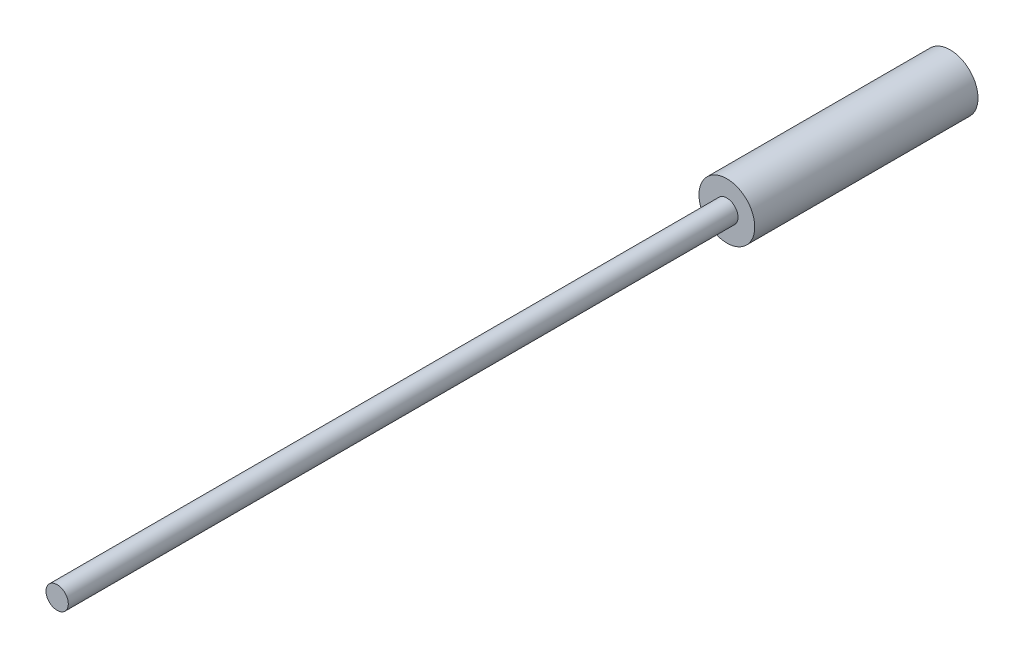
SolidWorks part; units mm, degrees
ref_plane "前视基准面" through (0, 0, 0) normal (0, 0, 1) x (1, 0, 0)
ref_plane "上视基准面" through (0, 0, 0) normal (0, 1, 0) x (1, 0, 0)
ref_plane "右视基准面" through (0, 0, 0) normal (1, 0, 0) x (0, 0, -1)
sketch "草图1" plane through (0, 0, 0) normal (0, 0, 1) x (1, 0, 0)
  circle A0 centre (0, 0) radius 1.25
  dimension "D1" = 2.5
extrude "凸台-拉伸1" add sketch "草图1" along normal blind 10
sketch "草图2" plane through (0, 0, 10) normal (0, 0, 1) x (1, 0, 0)
  circle A0 centre (0, 0) radius 0.5
  dimension "D1" = 1
extrude "凸台-拉伸2" add sketch "草图2" along normal blind 30
sketch "草图3" plane through (0, 0, 0) normal (0, 0, -1) x (-1, 0, 0)
  circle A0 centre (0, 0) radius 0.0625
  circle A1 centre (0, 0) radius 0.0675
  dimension "D1" = 0.135
  dimension "D2" = 0.125
extrude "切除-拉伸1" cut sketch "草图3" against normal blind 0.1
